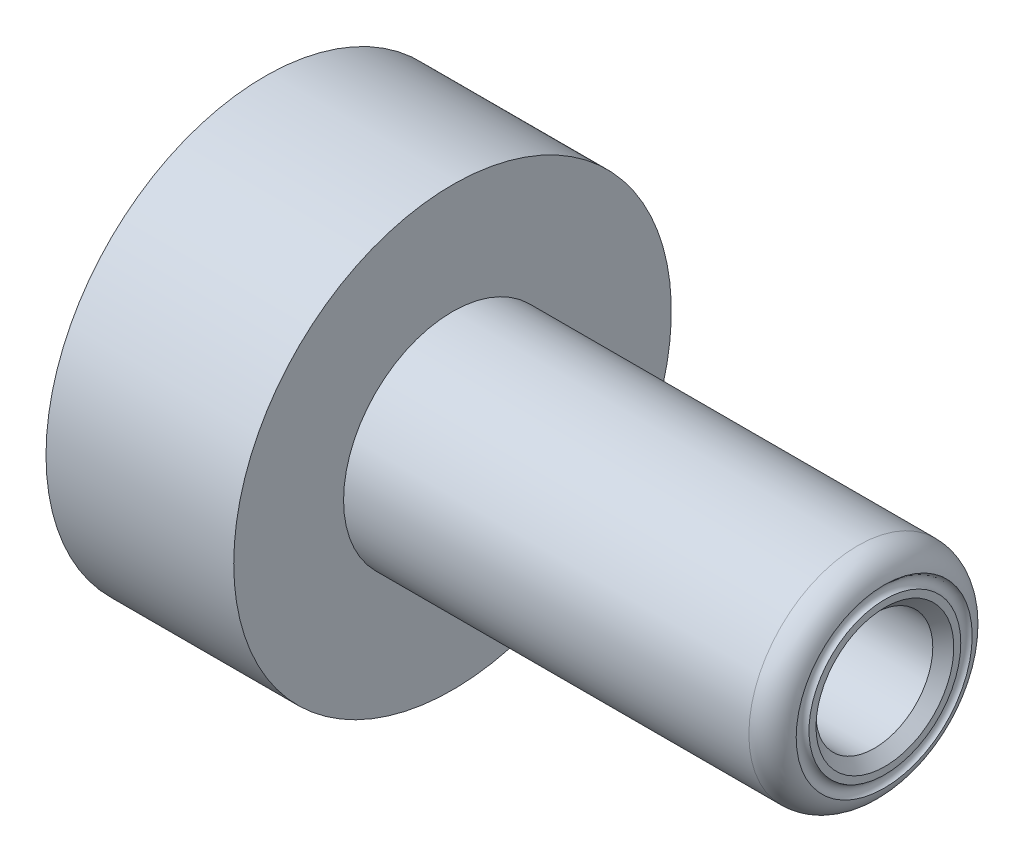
SolidWorks part; units mm, degrees
ref_plane "Front Plane" through (0, 0, 0) normal (0, 0, 1) x (1, 0, 0)
ref_plane "Top Plane" through (0, 0, 0) normal (0, 1, 0) x (1, 0, 0)
ref_plane "Right Plane" through (0, 0, 0) normal (1, 0, 0) x (0, 0, -1)
sketch "Sketch1" plane through (0, 0, 0) normal (0, 0, 1) x (1, 0, 0)
  line L0 (0, 0) -> (102.3864, 0) construction
  line L1 (0, 3.9751) -> (0, 12.7)
  line L2 (0, 12.7) -> (10.8966, 12.7)
  line L3 (10.8966, 12.7) -> (10.8966, 6.3246)
  line L4 (10.8966, 6.3246) -> (34.4218, 6.3246)
  line L5 (35.9918, 4.7546) -> (35.9918, 0)
  line L6 (35.9918, 0) -> (21.8948, 0)
  line L7 (0, 3.9751) -> (21.8948, 3.9751)
  line L8 (21.8948, 3.9751) -> (21.8948, 0)
  arc A0 (35.9918, 4.7546) -> (34.4218, 6.3246) centre (34.4218, 4.7546) ccw
  dimension "D5" = 1.57
  dimension "D1" = 10.8966
  dimension "D2" = 25.4
  dimension "D3" = 21.8948
  dimension "D4" = 7.9502
  dimension "D6" = 35.9918
  dimension "D7" = 12.6492
revolve "Revolve1" add sketch "Sketch1" angle 360 about L0
sketch "Sketch2" plane through (0, 0, 0) normal (-1, 0, 0) x (0, 0, 1)
  line L0 (0, 0) -> (0, 9.7644) construction
  circle A0 centre (-7.1374, 0) radius 1.6129
  circle A1 centre (7.1374, 0) radius 1.6129
  dimension "D2" = 3.2258
  dimension "D1" = 14.2748
extrude "Cut-Extrude1" cut sketch "Sketch2" against normal blind 6.35
sketch "Sketch3" plane through (35.9918, 0, 0) normal (1, 0, 0) x (0, 0, -1)
  circle A0 centre (0, 0) radius 3.39
  dimension "D1" = 6.78
extrude "Cut-Extrude2" cut sketch "Sketch3" against normal through all
chamfer "Chamfer1" distance 0.61 angle 45 1 edges at (35.9918, 0, -3.39)
sketch "Sketch4" plane through (0, 0, 0) normal (0, 0, 1) x (1, 0, 0)
  line L0 (0, 0) -> (37.8952, 0) construction
  line L1 (0, 12.7) -> (0, -12.7) construction
  circle A0 centre (36.117, 4.765) radius 0.381
  dimension "D1" = 36.117
  dimension "D3" = 0.381
  dimension "D2" = 4.765
revolve "Cut-Revolve1" cut sketch "Sketch4" angle 360 about L0
